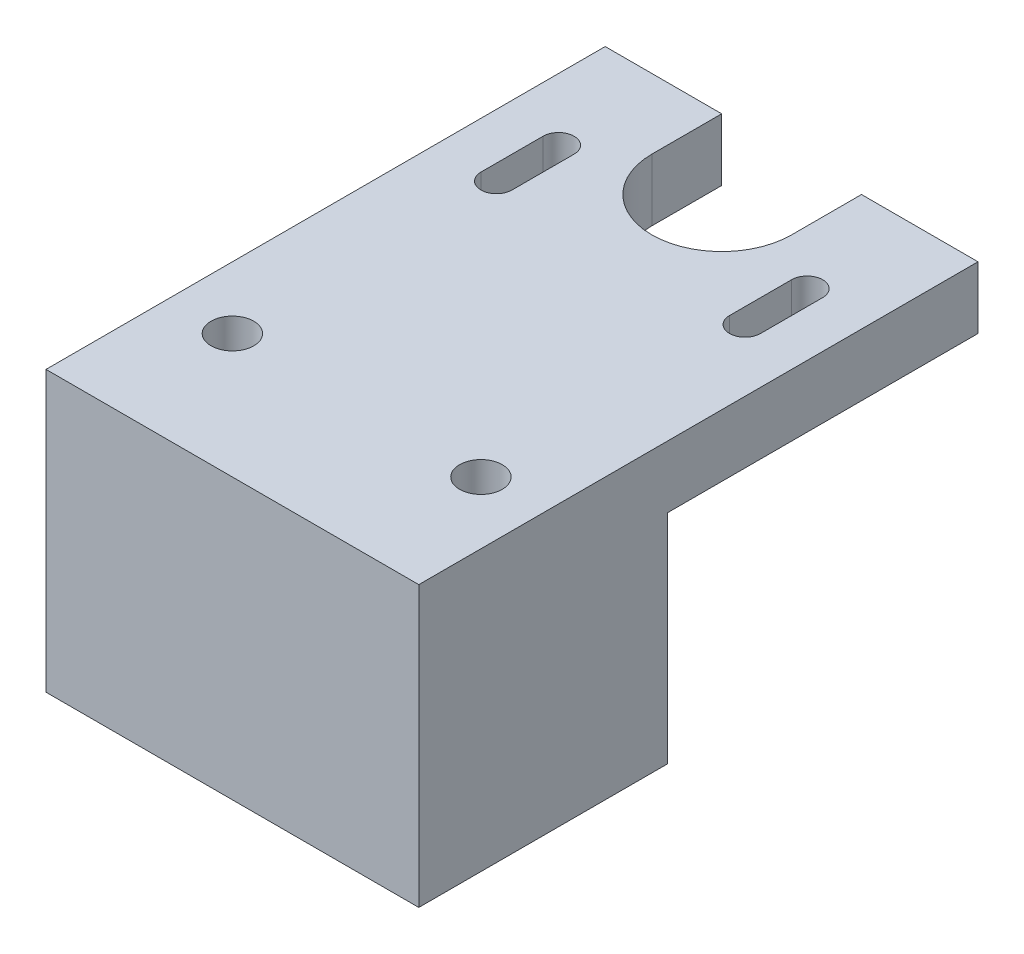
SolidWorks part; units mm, degrees
ref_plane "Front Plane" through (0, 0, 0) normal (0, 0, 1) x (1, 0, 0)
ref_plane "Top Plane" through (0, 0, 0) normal (0, 1, 0) x (1, 0, 0)
ref_plane "Right Plane" through (0, 0, 0) normal (1, 0, 0) x (0, 0, -1)
sketch "Sketch2" plane through (0, 0, 0) normal (1, 0, 0) x (0, 0, -1)
  line L0 (0, 0) -> (0, 57.15)
  line L1 (0, 57.15) -> (114.3, 57.15)
  line L2 (114.3, 57.15) -> (114.3, 44.45)
  line L3 (114.3, 44.45) -> (50.8, 44.45)
  line L4 (50.8, 44.45) -> (50.8, 0)
  line L5 (50.8, 0) -> (0, 0)
  dimension "D1" = 57.15
  dimension "D2" = 114.3
  dimension "D3" = 12.7
  dimension "D4" = 50.8
extrude "Boss-Extrude1" add sketch "Sketch2" along normal mid plane 76.2
sketch "Sketch3" plane through (0, 57.15, 0) normal (0, 1, 0) x (1, 0, 0)
  line L0 (0, 0) -> (0, 145.0068) construction
  line L1 (25.4, 92.075) -> (25.4, 79.375) construction
  line L2 (38.1, 0) -> (-38.1, 0) construction
  line L3 (-14.2875, 114.3) -> (-14.2875, 100.0125)
  line L4 (38.1, 114.3) -> (-38.1, 114.3) construction
  line L5 (14.2875, 114.3) -> (14.2875, 100.0125)
  line L6 (0, 85.725) -> (55.1873, 85.725) construction
  line L7 (-14.2875, 114.3) -> (14.2875, 114.3)
  line L8 (28.575, 92.075) -> (28.575, 79.375)
  line L9 (22.225, 92.075) -> (22.225, 79.375)
  line L10 (-25.4, 92.075) -> (-25.4, 79.375) construction
  line L11 (-28.575, 92.075) -> (-28.575, 79.375)
  line L12 (-22.225, 92.075) -> (-22.225, 79.375)
  circle A0 centre (-25.4, 25.4) radius 4.3688
  circle A1 centre (25.4, 25.4) radius 4.3688
  arc A2 (-14.2875, 100.0125) -> (14.2875, 100.0125) centre (0, 100.0125) ccw
  arc A3 (28.575, 92.075) -> (22.225, 92.075) centre (25.4, 92.075) ccw
  arc A4 (22.225, 79.375) -> (28.575, 79.375) centre (25.4, 79.375) ccw
  arc A5 (-28.575, 92.075) -> (-22.225, 92.075) centre (-25.4, 92.075) cw
  arc A6 (-22.225, 79.375) -> (-28.575, 79.375) centre (-25.4, 79.375) cw
  point P20 (25.4, 85.725)
  point P27 (-25.4, 85.725)
  dimension "D1" = 50.8
  dimension "D2" = 8.7376
  dimension "D4" = 28.575
  dimension "D3" = 25.4
  dimension "D5" = 28.575
  dimension "D6" = 6.35
  dimension "D7" = 12.7
  dimension "D8" = 25.4
extrude "Cut-Extrude1" cut sketch "Sketch3" against normal through all
